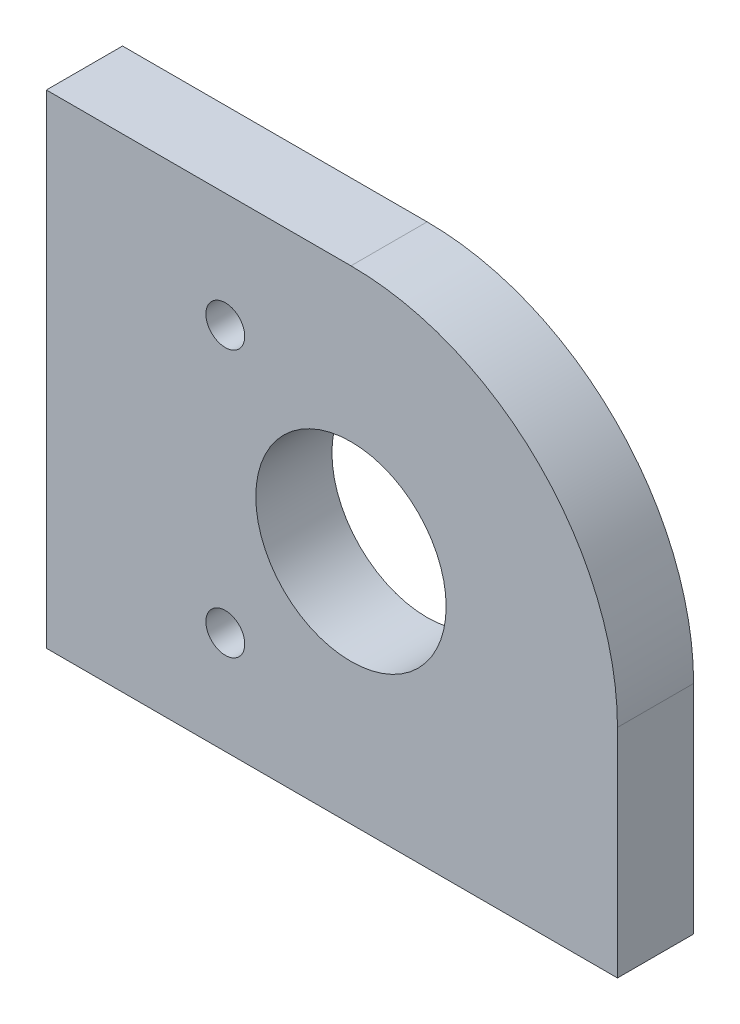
SolidWorks part; units mm, degrees
ref_plane "Plan de face" through (0, 0, 0) normal (0, 0, 1) x (1, 0, 0)
ref_plane "Plan de dessus" through (0, 0, 0) normal (0, 1, 0) x (1, 0, 0)
ref_plane "Plan de droite" through (0, 0, 0) normal (1, 0, 0) x (0, 0, -1)
sketch "Esquisse1" plane through (0, 0, 0) normal (0, 0, 1) x (1, 0, 0)
  line L0 (0, 65) -> (-80, 65)
  line L1 (-80, 65) -> (-80, -62)
  line L2 (-80, -62) -> (70, -62)
  line L3 (70, -62) -> (70, -5)
  circle A0 centre (0, 0) radius 25
  arc A1 (70, -5) -> (0, 65) centre (0, -5) ccw
  dimension "D1" = 50
  dimension "D6" = 70
  dimension "D2" = 80
  dimension "D3" = 150
  dimension "D4" = 127
  dimension "D5" = 65
extrude "Extrusion1" add sketch "Esquisse1" along normal blind 20
hole_wizard "Trou taraudé M121" positions "Esquisse3" profile "Esquisse2" tap size "M12" standard "ISO"
sketch "Esquisse3" plane through (0, 0, 20) normal (0, 0, 1) x (1, 0, 0)
  point P0 (-33, 35)
  point P1 (-33, -35)
  dimension "D1" = 70
  dimension "D2" = 35
  dimension "D3" = 33
sketch "Esquisse2" plane through (-33, 35, 20) normal (1, 0, 0) x (0, -1, 0)
  line L0 (0, 0) -> (0, 20)
  line L1 (0, 20) -> (5.1, 20)
  line L2 (5.1, 20) -> (5.1, 0)
  line L5 (5.1, 0) -> (0, 0)
  line L11 (0, -6.35) -> (0, 107.95) construction
  dimension "Diamètre du trou pour taraudage jusqu'au prochain" = 10.2
  dimension "Profondeur du trou pour taraudage jusqu'au prochain" = 20
